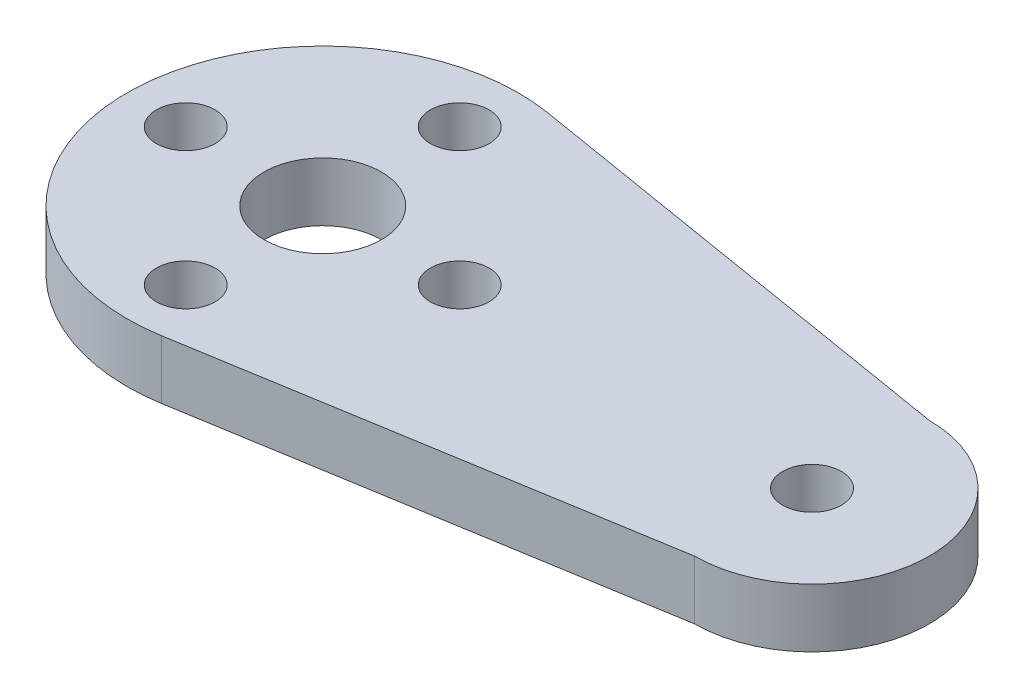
SolidWorks part; units mm, degrees
ref_plane "Front Plane" through (0, 0, 0) normal (0, 0, 1) x (1, 0, 0)
ref_plane "Top Plane" through (0, 0, 0) normal (0, 1, 0) x (1, 0, 0)
ref_plane "Right Plane" through (0, 0, 0) normal (1, 0, 0) x (0, 0, -1)
sketch "Sketch1" plane through (0, 0, 0) normal (0, 1, 0) x (1, 0, 0)
  line L0 (1.6322, 9.8659) -> (25, 6)
  line L1 (-14.4386, 0) -> (34.6115, 0)
  line L2 (1.6322, -9.8659) -> (25, -6)
  circle A0 centre (0, 0) radius 10
  circle A2 centre (25, 0) radius 6
  circle A3 centre (25, 0) radius 1.5
  circle A4 centre (0, 7) radius 1.5
  circle A8 centre (7, 0) radius 1.5
  circle A9 centre (0, -7) radius 1.5
  circle A10 centre (-7, 0) radius 1.5
  circle A11 centre (0, 0) radius 3
  point P23 (0, 0)
  point P24 (0, 0)
  dimension "D1" = 20
  dimension "D2" = 12
  dimension "D3" = 3
  dimension "D4" = 3
  dimension "D9" = 6
  dimension "D5" = 7
  dimension "D7" = 49.0501
  dimension "D8" = 25
  dimension "D6" = 4
extrude "Boss-Extrude1" add sketch "Sketch1" along normal blind 3 contours A10 L1 A8 A0 A4 | A10 L1 A0 A8 A9 | A2 L0 A0 L1 | A2 L1 A0 L2 | A3 L1 A2 | A3 L1 A2
